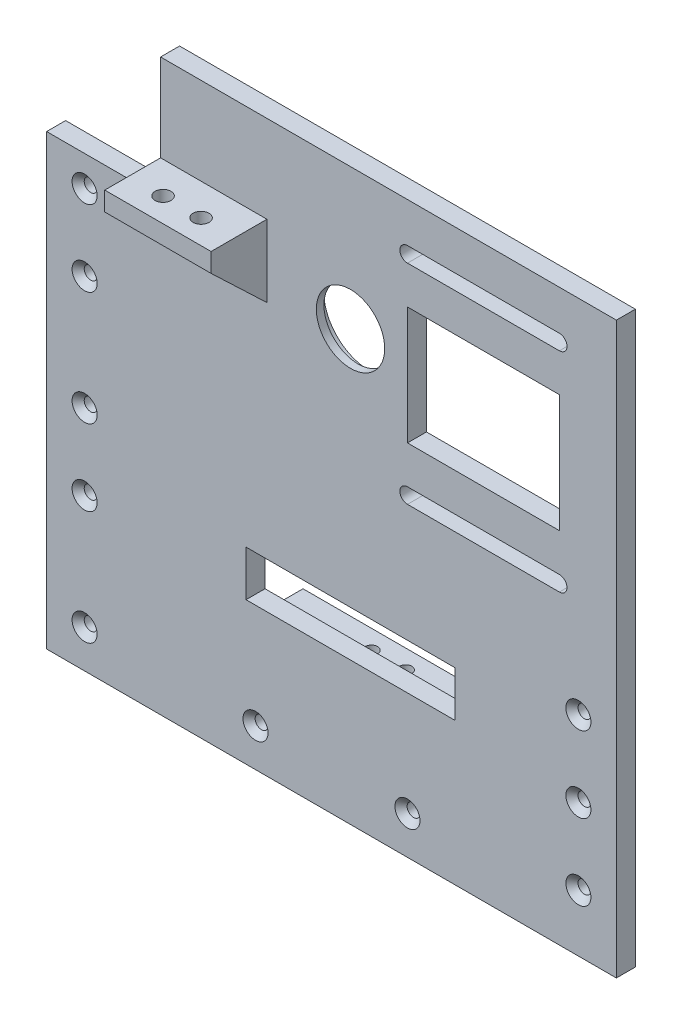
SolidWorks part; units mm, degrees
ref_plane "前视基准面" through (0, 0, 0) normal (0, 0, 1) x (1, 0, 0)
ref_plane "上视基准面" through (0, 0, 0) normal (0, 1, 0) x (1, 0, 0)
ref_plane "右视基准面" through (0, 0, 0) normal (1, 0, 0) x (0, 0, -1)
other "Configuration Table"
sketch "草图1" plane through (0, 0, 0) normal (0, 0, 1) x (1, 0, 0)
  line L1 (-75, 75) -> (75, 75)
  line L2 (-75, 75) -> (-75, -75)
  line L3 (-75, -75) -> (75, -75)
  line L4 (75, 75) -> (75, -75)
  line L5 (-75, 75) -> (75, -75) construction
  line L6 (-75, -75) -> (75, 75) construction
  point P0 (0, 0)
  dimension "D1" = 150
  dimension "D2" = 150
extrude "凸台-拉伸1" add sketch "草图1" along normal blind 5
hole_wizard "M3 十字槽沉头木螺钉的锥形沉头孔1" positions "草图2" profile "草图3" countersink size "M3" standard "GB"
sketch "草图2" plane through (0, 0, 5) normal (0, 0, 1) x (1, 0, 0)
  line L0 (-75, -75) -> (75, -75) construction
  line L1 (-75, 75) -> (-75, -75) construction
  point P0 (-65, -65)
  dimension "D1" = 10
  dimension "D2" = 10
sketch "草图3" plane through (-65, -65, 5) normal (1, 0, 0) x (0, -1, 0)
  line L0 (0, 0) -> (0, 12.5215)
  line L1 (0, 12.5215) -> (1.7, 11.5)
  line L2 (1.7, 11.5) -> (1.7, 1.6)
  line L3 (1.7, 1.6) -> (3.3, 0)
  line L5 (3.3, 0) -> (0, 0)
  line L6 (-1.7, 1.6) -> (-3.3, 0) construction
  line L10 (0, 12.5215) -> (-1.7, 11.5) construction
  line L11 (0, -6.35) -> (0, 107.95) construction
  dimension "孔直径" = 3.4
  dimension "孔深度" = 11.5
  dimension "近端锥形沉头孔直径" = 6.6
  dimension "近端锥形沉头孔角度" = 90
  dimension "导头角度" = 118
hole_wizard "M3 十字槽沉头木螺钉的锥形沉头孔2" positions "草图4" profile "草图5" countersink size "M3" standard "GB"
sketch "草图4" plane through (0, 0, 5) normal (0, 0, 1) x (1, 0, 0)
  line L0 (-75, 75) -> (-75, -75) construction
  line L1 (-75, -75) -> (75, -75) construction
  line L2 (75, 75) -> (-75, 75) construction
  point P0 (-65, 35)
  point P2 (-65, 15)
  point P4 (-65, -15)
  point P6 (-65, -35)
  dimension "D1" = 10
  dimension "D2" = 10
  dimension "D3" = 10
  dimension "D4" = 10
  dimension "D5" = 40
  dimension "D6" = 20
  dimension "D7" = 40
  dimension "D8" = 20
sketch "草图5" plane through (-65, 35, 5) normal (1, 0, 0) x (0, -1, 0)
  line L0 (0, 0) -> (0, 12.5215)
  line L1 (0, 12.5215) -> (1.7, 11.5)
  line L2 (1.7, 11.5) -> (1.7, 1.6)
  line L3 (1.7, 1.6) -> (3.3, 0)
  line L5 (3.3, 0) -> (0, 0)
  line L6 (-1.7, 1.6) -> (-3.3, 0) construction
  line L10 (0, 12.5215) -> (-1.7, 11.5) construction
  line L11 (0, -6.35) -> (0, 107.95) construction
  dimension "孔直径" = 3.4
  dimension "孔深度" = 11.5
  dimension "近端锥形沉头孔直径" = 6.6
  dimension "近端锥形沉头孔角度" = 90
  dimension "导头角度" = 118
hole_wizard "M3 十字槽沉头木螺钉的锥形沉头孔3" positions "草图6" profile "草图7" countersink size "M3" standard "GB"
sketch "草图6" plane through (0, 0, 5) normal (0, 0, 1) x (1, 0, 0)
  line L0 (-75, -75) -> (75, -75) construction
  line L1 (-75, 75) -> (-75, -75) construction
  line L2 (75, -75) -> (75, 75) construction
  point P0 (-20, -65)
  point P2 (20, -65)
  dimension "D1" = 10
  dimension "D2" = 10
  dimension "D3" = 55
  dimension "D4" = 55
sketch "草图7" plane through (-20, -65, 5) normal (1, 0, 0) x (0, -1, 0)
  line L0 (0, 0) -> (0, 12.5215)
  line L1 (0, 12.5215) -> (1.7, 11.5)
  line L2 (1.7, 11.5) -> (1.7, 1.6)
  line L3 (1.7, 1.6) -> (3.3, 0)
  line L5 (3.3, 0) -> (0, 0)
  line L6 (-1.7, 1.6) -> (-3.3, 0) construction
  line L10 (0, 12.5215) -> (-1.7, 11.5) construction
  line L11 (0, -6.35) -> (0, 107.95) construction
  dimension "孔直径" = 3.4
  dimension "孔深度" = 11.5
  dimension "近端锥形沉头孔直径" = 6.6
  dimension "近端锥形沉头孔角度" = 90
  dimension "导头角度" = 118
sketch "草图8" plane through (0, 0, 5) normal (0, 0, 1) x (1, 0, 0)
  line L0 (-75, -75) -> (75, -75) construction
  line L1 (-45, 52) -> (-17, 52)
  line L2 (-45, 52) -> (-45, 47)
  line L3 (-45, 47) -> (-17, 47)
  line L4 (-17, 52) -> (-17, 47)
  line L5 (-75, 75) -> (-75, -75) construction
  dimension "D1" = 28
  dimension "D2" = 5
  dimension "D3" = 122
  dimension "D4" = 30
extrude "凸台-拉伸2" add sketch "草图8" along normal blind 14.7
sketch "草图9" plane through (-45, 0, 0) normal (-1, 0, 0) x (0, 0, 1)
  line L0 (5, 47) -> (5, 37)
  line L1 (5, 75) -> (5, -75) construction
  line L2 (5, 37) -> (19.7, 47)
  line L3 (5, 47) -> (19.7, 47)
  dimension "D1" = 10
extrude "凸台-拉伸3" add sketch "草图9" against normal blind 4
sketch "草图10" plane through (-17, 0, 0) normal (1, 0, 0) x (0, 0, -1)
  line L0 (-19.7, 47) -> (-5, 37)
  line L1 (-5, 37) -> (-5, 47)
  line L2 (-5, -75) -> (-5, 75) construction
  line L3 (-19.7, 47) -> (-5, 47) construction
  line L4 (-5, 47) -> (-19.7, 47)
extrude "凸台-拉伸4" add sketch "草图10" against normal blind 4
hole_wizard "M5 螺纹孔1" positions "草图11" profile "草图12" tap size "M5" standard "GB"
sketch "草图11" plane through (0, 47, 0) normal (0, -1, 0) x (-1, 0, 0)
  line L0 (45, -5) -> (45, -19.7) construction
  line L1 (17, -19.7) -> (17, -5) construction
  line L2 (75, -5) -> (-75, -5) construction
  line L3 (41, -5) -> (21, -5) construction
  point P0 (26, -13.35)
  point P2 (36, -13.35)
  dimension "D1" = 9
  dimension "D2" = 9
  dimension "D3" = 8.35
  dimension "D4" = 8.35
sketch "草图12" plane through (-26, 47, 13.35) normal (1, 0, 0) x (0, 0, -1)
  line L0 (0, 0) -> (0, 15.2618)
  line L1 (0, 15.2618) -> (2.1, 14)
  line L2 (2.1, 14) -> (2.1, 0)
  line L5 (2.1, 0) -> (0, 0)
  line L10 (0, 15.2618) -> (-2.1, 14) construction
  line L11 (0, -6.35) -> (0, 107.95) construction
  dimension "螺纹孔钻头直径" = 4.2
  dimension "螺纹孔钻头深度" = 14
  dimension "导头角度" = 118
sketch "草图14" plane through (0, 0, 5) normal (0, 0, 1) x (1, 0, 0)
  line L5 (-75, 75) -> (-45, 75)
  line L6 (-75, 75) -> (-75, 43)
  line L7 (-75, 43) -> (-45, 43)
  line L8 (-45, 75) -> (-45, 43)
  dimension "D1" = 32
  dimension "D2" = 30
extrude "切除-拉伸2" cut sketch "草图14" against normal blind 10
sketch "草图15" plane through (0, 0, 5) normal (0, 0, 1) x (1, 0, 0)
  line L0 (-75, -75) -> (75, -75) construction
  line L1 (-75, 43) -> (-75, -75) construction
  circle A0 centre (5, 38) radius 9
  dimension "D1" = 18
  dimension "D2" = 113
  dimension "D3" = 80
extrude "切除-拉伸3" cut sketch "草图15" against normal blind 10
sketch "草图16" plane through (0, 0, 0) normal (0, 0, -1) x (-1, 0, 0)
  circle A0 centre (-5, 38) radius 12.05
  dimension "D1" = 24.1
extrude "切除-拉伸4" cut sketch "草图16" against normal blind 3
sketch "草图17" plane through (0, 0, 5) normal (0, 0, 1) x (1, 0, 0)
  line L0 (-75, 43) -> (-75, -75) construction
  line L1 (-22.5, -42.5) -> (32.5, -42.5)
  line L2 (-22.5, -42.5) -> (-22.5, -47.5)
  line L3 (-22.5, -47.5) -> (32.5, -47.5)
  line L4 (32.5, -42.5) -> (32.5, -47.5)
  line L5 (-22.5, -42.5) -> (32.5, -47.5) construction
  line L6 (-22.5, -47.5) -> (32.5, -42.5) construction
  line L7 (-75, -75) -> (75, -75) construction
  point P0 (5, -45)
  dimension "D1" = 55
  dimension "D2" = 80
  dimension "D3" = 5
  dimension "D4" = 30
extrude "凸台-拉伸5" add sketch "草图17" along normal blind 10
sketch "草图18" plane through (-22.5, 0, 0) normal (-1, 0, 0) x (0, 0, 1)
  line L0 (15, -47.5) -> (5, -47.5)
  line L1 (5, -47.5) -> (5, -57.5)
  line L2 (5, 43) -> (5, -75) construction
  line L3 (5, -57.5) -> (15, -47.5)
  dimension "D1" = 10
extrude "凸台-拉伸6" add sketch "草图18" against normal blind 5
sketch "草图19" plane through (32.5, 0, 0) normal (1, 0, 0) x (0, 0, -1)
  line L0 (-15, -47.5) -> (-5, -47.5)
  line L1 (-5, -47.5) -> (-5, -57.5)
  line L2 (-5, -57.5) -> (-15, -47.5)
extrude "凸台-拉伸7" add sketch "草图19" against normal blind 5
sketch "草图21" plane through (0, 0, 5) normal (0, 0, 1) x (1, 0, 0)
  line L0 (-75, 43) -> (-75, -75) construction
  line L1 (20, 50.5) -> (60, 50.5)
  line L2 (20, 50.5) -> (20, 19.5)
  line L3 (20, 19.5) -> (60, 19.5)
  line L4 (60, 50.5) -> (60, 19.5)
  line L5 (20, 50.5) -> (60, 19.5) construction
  line L6 (20, 19.5) -> (60, 50.5) construction
  line L7 (-75, -75) -> (75, -75) construction
  line L8 (20, 62.5) -> (60, 62.5) construction
  line L9 (20, 64.5) -> (60, 64.5)
  line L10 (20, 60.5) -> (60, 60.5)
  line L11 (20, 7.5) -> (60, 7.5) construction
  line L12 (20, 9.5) -> (60, 9.5)
  line L13 (20, 5.5) -> (60, 5.5)
  arc A0 (20, 64.5) -> (20, 60.5) centre (20, 62.5) ccw
  arc A1 (60, 60.5) -> (60, 64.5) centre (60, 62.5) ccw
  arc A2 (20, 9.5) -> (20, 5.5) centre (20, 7.5) ccw
  arc A3 (60, 5.5) -> (60, 9.5) centre (60, 7.5) ccw
  point P0 (40, 35)
  point P11 (40, 62.5)
  point P16 (40, 7.5)
  dimension "D5" = 2
  dimension "D6" = 2
  dimension "D1" = 40
  dimension "D2" = 31
  dimension "D3" = 95
  dimension "D4" = 110
  dimension "D7" = 10
  dimension "D8" = 10
extrude "切除-拉伸6" cut sketch "草图21" against normal blind 5
hole_wizard "M3 十字槽沉头木螺钉的锥形沉头孔4" positions "草图23" profile "草图24" countersink size "M3" standard "GB"
sketch "草图23" plane through (0, 0, 5) normal (0, 0, 1) x (1, 0, 0)
  line L0 (75, -75) -> (75, 75) construction
  line L1 (-75, -75) -> (75, -75) construction
  point P0 (65, -20)
  point P2 (65, -40)
  point P4 (65, -60)
  dimension "D1" = 10
  dimension "D2" = 10
  dimension "D3" = 10
  dimension "D4" = 15
  dimension "D5" = 20
  dimension "D6" = 20
sketch "草图24" plane through (65, -20, 5) normal (1, 0, 0) x (0, -1, 0)
  line L0 (0, 0) -> (0, 8.0215)
  line L1 (0, 8.0215) -> (1.7, 7)
  line L2 (1.7, 7) -> (1.7, 1.6)
  line L3 (1.7, 1.6) -> (3.3, 0)
  line L5 (3.3, 0) -> (0, 0)
  line L6 (-1.7, 1.6) -> (-3.3, 0) construction
  line L10 (0, 8.0215) -> (-1.7, 7) construction
  line L11 (0, -6.35) -> (0, 107.95) construction
  dimension "孔直径" = 3.4
  dimension "孔深度" = 7
  dimension "近端锥形沉头孔直径" = 6.6
  dimension "近端锥形沉头孔角度" = 90
  dimension "导头角度" = 118
ref_plane "基准面1" through (0, 0, 2.5) normal (0, 0, 1) x (1, 0, 0)
mirror "镜向1" about plane through (0, 0, 2.5) normal (0, 0, 1) of "凸台-拉伸7", "凸台-拉伸6", "凸台-拉伸5", "凸台-拉伸3", "凸台-拉伸4", "M5 螺纹孔1", "凸台-拉伸2"
sketch "草图26" plane through (0, 0, 19.7) normal (0, 0, 1) x (1, 0, 0)
  line L1 (-94.7026, 87.2219) -> (121.283, 87.2219)
  line L2 (-94.7026, 87.2219) -> (-94.7026, -91.9968)
  line L3 (-94.7026, -91.9968) -> (121.283, -91.9968)
  line L4 (121.283, 87.2219) -> (121.283, -91.9968)
extrude "切除-拉伸9" cut sketch "草图26" against normal up to surface (14.7 mm away)
sketch "草图27" plane through (0, 0, 0) normal (0, 0, -1) x (-1, 0, 0)
  line L0 (-32.5, -42.5) -> (22.5, -42.5) construction
  line L1 (-32.5, -25.5) -> (22.5, -25.5)
  line L2 (-32.5, -25.5) -> (-32.5, -37.5)
  line L3 (-32.5, -37.5) -> (22.5, -37.5)
  line L4 (22.5, -25.5) -> (22.5, -37.5)
  line L5 (-32.5, -57.5) -> (-32.5, -42.5) construction
  dimension "D1" = 5
  dimension "D2" = 12
  dimension "D3" = 55
  dimension "D4" = 0
extrude "切除-拉伸10" cut sketch "草图27" against normal blind 10
hole_wizard "M4 螺纹孔1" positions "草图28" profile "草图29" tap size "M4" standard "GB"
sketch "草图28" plane through (0, -42.5, 0) normal (0, 1, 0) x (1, 0, 0)
  line L0 (32.5, 10) -> (-22.5, 10) construction
  line L1 (32.5, 10) -> (32.5, 0) construction
  point P0 (0.5, 5)
  point P2 (9.5, 5)
  dimension "D1" = 5
  dimension "D2" = 5
  dimension "D3" = 23
  dimension "D4" = 9
sketch "草图29" plane through (0.5, -42.5, -5) normal (1, 0, 0) x (0, 0, 1)
  line L0 (0, 0) -> (0, 12.4914)
  line L1 (0, 12.4914) -> (1.65, 11.5)
  line L2 (1.65, 11.5) -> (1.65, 0)
  line L5 (1.65, 0) -> (0, 0)
  line L10 (0, 12.4914) -> (-1.65, 11.5) construction
  line L11 (0, -6.35) -> (0, 107.95) construction
  dimension "螺纹孔钻头直径" = 3.3
  dimension "螺纹孔钻头深度" = 11.5
  dimension "导头角度" = 118
sketch "草图30" plane through (0, 0, -14.7) normal (0, 0, -1) x (-1, 0, 0)
  line L1 (11.2862, 61.3505) -> (51.8007, 61.3505)
  line L2 (11.2862, 61.3505) -> (11.2862, 33.1351)
  line L3 (11.2862, 33.1351) -> (51.8007, 33.1351)
  line L4 (51.8007, 61.3505) -> (51.8007, 33.1351)
extrude "切除-拉伸11" cut sketch "草图30" against normal up to surface (14.7 mm away)
sketch "草图31" plane through (0, 0, 5) normal (0, 0, 1) x (1, 0, 0)
  line L0 (-45, 43) -> (-45, 75) construction
  line L1 (-45, 52) -> (-17, 52)
  line L2 (-45, 52) -> (-45, 47)
  line L3 (-45, 47) -> (-17, 47)
  line L4 (-17, 52) -> (-17, 47)
  line L5 (-75, -75) -> (75, -75) construction
  dimension "D1" = 28
  dimension "D2" = 5
  dimension "D3" = 122
extrude "凸台-拉伸8" add sketch "草图31" along normal blind 14.7
sketch "草图32" plane through (-45, 0, 0) normal (-1, 0, 0) x (0, 0, 1)
  line L0 (19.7, 47) -> (5, 47)
  line L1 (5, 47) -> (5, 33)
  line L2 (5, 43) -> (5, -75) construction
  line L3 (5, 33) -> (19.7, 47)
  dimension "D1" = 14
extrude "凸台-拉伸9" add sketch "草图32" against normal blind 4
sketch "草图33" plane through (-17, 0, 0) normal (1, 0, 0) x (0, 0, -1)
  line L0 (-19.7, 47) -> (-5, 47)
  line L1 (-5, 47) -> (-5, 33)
  line L2 (-5, 33) -> (-19.7, 47)
extrude "凸台-拉伸10" add sketch "草图33" against normal blind 4
hole_wizard "M5 螺纹孔2" positions "草图34" profile "草图35" tap size "M5" standard "GB"
sketch "草图34" plane through (0, 52, 0) normal (0, 1, 0) x (1, 0, 0)
  line L0 (-17, -19.7) -> (-45, -19.7) construction
  line L1 (-45, -19.7) -> (-45, -5) construction
  line L2 (-17, -19.7) -> (-17, -5) construction
  point P0 (-36, -13.35)
  point P2 (-26, -13.35)
  dimension "D1" = 6.35
  dimension "D2" = 6.35
  dimension "D3" = 9
  dimension "D4" = 9
sketch "草图35" plane through (-36, 52, 13.35) normal (1, 0, 0) x (0, 0, 1)
  line L0 (0, 0) -> (0, 127)
  line L1 (0, 127) -> (2.1, 127)
  line L2 (2.1, 127) -> (2.1, 0)
  line L5 (2.1, 0) -> (0, 0)
  line L11 (0, -6.35) -> (0, 107.95) construction
  dimension "通孔螺纹孔钻头直径" = 4.2
  dimension "通孔螺纹孔钻头深度" = 127
